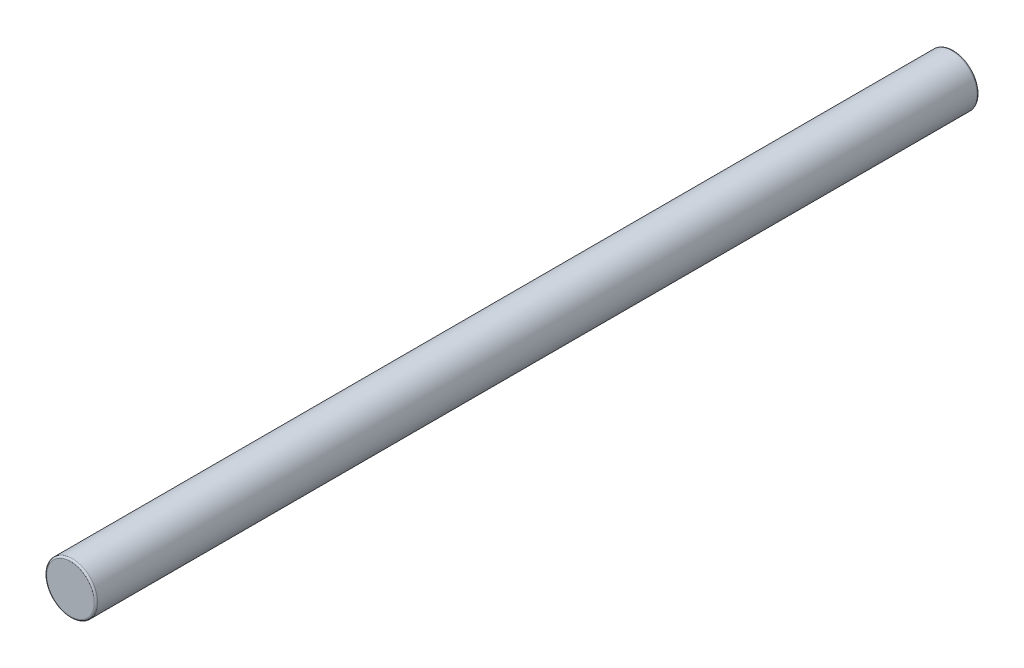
SolidWorks part; units mm, degrees
ref_plane "Plan de face" through (0, 0, 0) normal (0, 0, 1) x (1, 0, 0)
ref_plane "Plan de dessus" through (0, 0, 0) normal (0, 1, 0) x (1, 0, 0)
ref_plane "Plan de droite" through (0, 0, 0) normal (1, 0, 0) x (0, 0, -1)
sketch "Esquisse1" plane through (0, 0, 0) normal (0, 0, 1) x (1, 0, 0)
  circle A0 centre (0, 0) radius 1.5
  dimension "D1" = 3
extrude "Extrusion1" add sketch "Esquisse1" along normal blind 52
fillet "Congé1" radius 0.1 2 edges at (1.5, 0, 0) (1.5, 0, 52)
